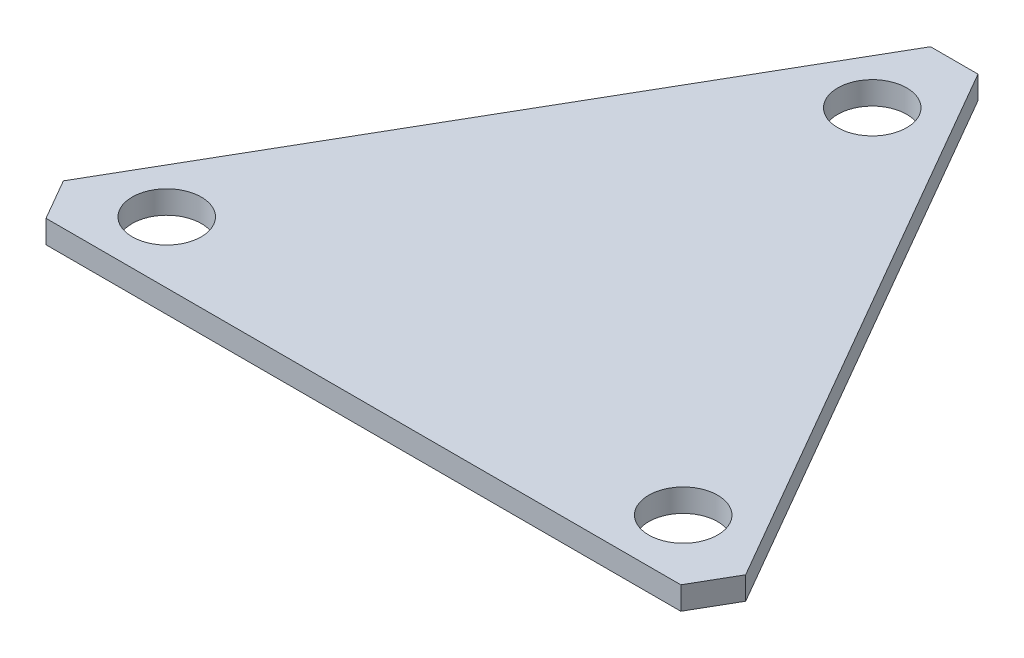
SolidWorks part; units mm, degrees
ref_plane "Front/Back" through (0, 0, 0) normal (0, 0, 1) x (1, 0, 0)
ref_plane "Top/Bottom" through (0, 0, 0) normal (0, 1, 0) x (1, 0, 0)
ref_plane "Right/Left" through (0, 0, 0) normal (1, 0, 0) x (0, 0, -1)
sketch "Sketch4" plane through (0, 0, 0) normal (0, 1, 0) x (1, 0, 0)
  line L0 (0, 0) -> (91.055, 0) construction
  line L1 (0, 0) -> (0, 26.3144) construction
  line L2 (-1.6425, 26.3144) -> (1.6425, 26.3144)
  line L3 (-1.6425, 26.3144) -> (-23.6102, -11.7347)
  line L4 (-21.9676, -14.5796) -> (21.9676, -14.5796)
  line L5 (23.6102, -11.7347) -> (1.6425, 26.3144)
  line L6 (-23.6102, -11.7347) -> (-21.9676, -14.5796)
  line L7 (23.6102, -11.7347) -> (21.9676, -14.5796)
  point P4 (0, -14.5796)
  dimension "D1" = 40.894
  dimension "D2" = 43.9353
  dimension "D3" = 60
  dimension "D4" = 60
extrude "Extrude2" add sketch "Sketch4" along normal blind 1.5875
sketch "Sketch5" plane through (0, 1.5875, 0) normal (0, 1, 0) x (1, 0, 0)
  line L0 (0, 0) -> (0, 20.6375) construction
  line L1 (0, 0) -> (17.8726, -10.3187) construction
  line L2 (0, 0) -> (-17.8726, -10.3188) construction
  circle A0 centre (0, 0) radius 20.6375 construction
  circle A1 centre (0, 20.6375) radius 2.3876
  circle A2 centre (-17.8726, -10.3188) radius 2.3876
  circle A3 centre (17.8726, -10.3187) radius 2.3876
  dimension "D1" = 41.275
  dimension "D4" = 4.7752
  dimension "D2" = 120
  dimension "D3" = 120
extrude "Cut-Extrude1" cut sketch "Sketch5" against normal through all
